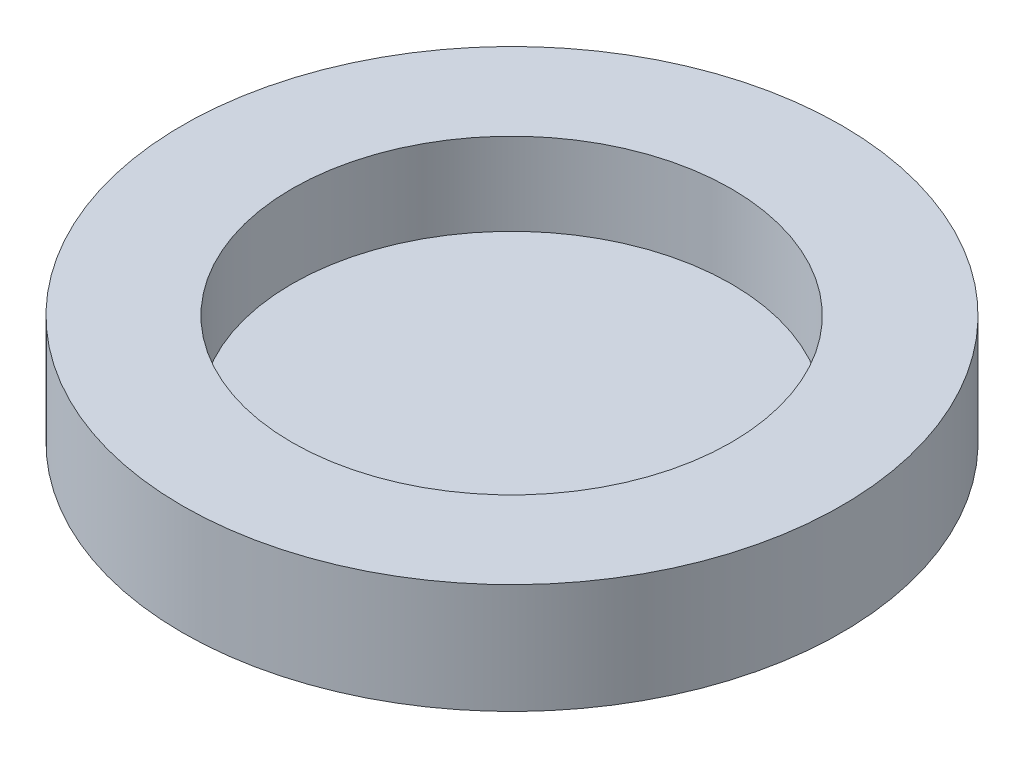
SolidWorks part; units mm, degrees
ref_plane "Front Plane" through (0, 0, 0) normal (0, 0, 1) x (1, 0, 0)
ref_plane "Top Plane" through (0, 0, 0) normal (0, 1, 0) x (1, 0, 0)
ref_plane "Right Plane" through (0, 0, 0) normal (1, 0, 0) x (0, 0, -1)
sketch "Sketch1" plane through (0, 0, 0) normal (0, 1, 0) x (1, 0, 0)
  circle A0 centre (0.3539, 0.177) radius 60
  dimension "D1" = 120
extrude "Boss-Extrude1" add sketch "Sketch1" along normal blind 20
sketch "Sketch2" plane through (0, 20, 0) normal (0, 1, 0) x (1, 0, 0)
  circle A0 centre (0.3187, 0.1456) radius 40
  dimension "D1" = 80
extrude "Cut-Extrude1" cut sketch "Sketch2" against normal blind 15 contours A0
